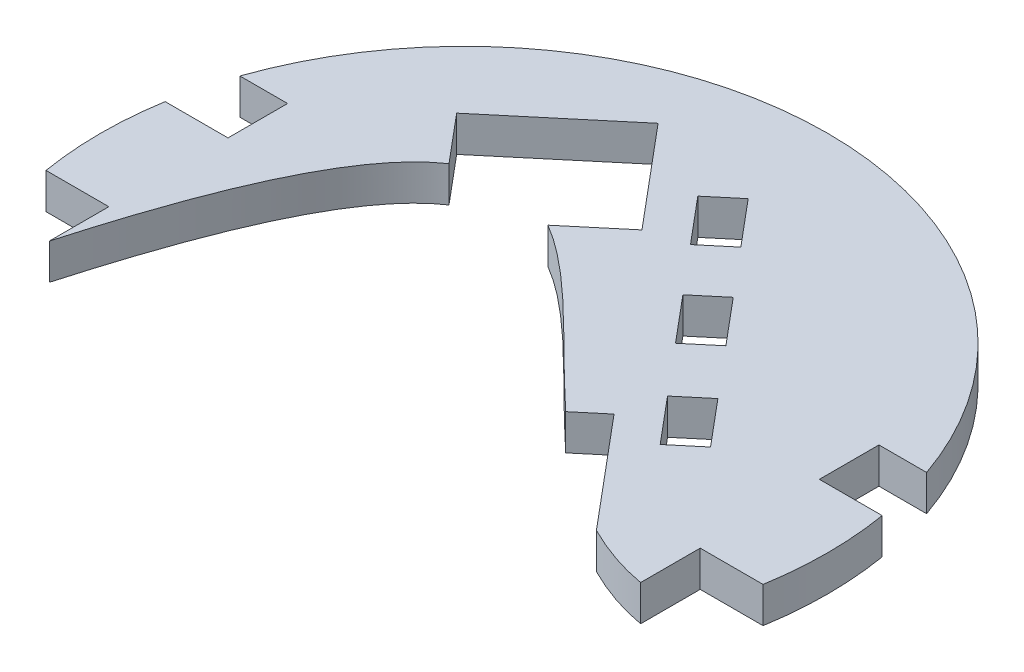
SolidWorks part; units mm, degrees
ref_plane "Alzado" through (0, 0, 0) normal (0, 0, 1) x (1, 0, 0)
ref_plane "Planta" through (0, 0, 0) normal (0, 1, 0) x (1, 0, 0)
ref_plane "Vista lateral" through (0, 0, 0) normal (1, 0, 0) x (0, 0, -1)
sketch "Croquis1" plane through (0, 0, 0) normal (0, 1, 0) x (1, 0, 0)
  circle A0 centre (0, 0) radius 30.5
extrude "Saliente-Extruir1" add sketch "Croquis1" along normal blind 3
sketch "Croquis2" plane through (0, 3, 0) normal (0, 1, 0) x (1, 0, 0)
  circle A0 centre (0, 0) radius 2
extrude "Cortar-Extruir1" cut sketch "Croquis2" against normal blind 4
sketch "Croquis5" plane through (0, 3, 0) normal (0, 1, 0) x (1, 0, 0)
  line L0 (0, 0) -> (0, 10)
  line L1 (28.8141, -5) -> (30.0874, -5)
  line L2 (28.8141, 5) -> (30.0874, 5)
  line L3 (-24.8141, 10) -> (-28.8141, 10)
  line L4 (24.8141, -5) -> (24.8141, -10)
  line L5 (-24.8141, -10) -> (-28.8141, -10)
  line L6 (24.8141, -5) -> (28.8141, -5)
  line L7 (24.8141, 5) -> (24.8141, 10)
  line L8 (-24.8141, 5) -> (-28.8141, 5)
  line L9 (-24.8141, 5) -> (-24.8141, 10)
  line L10 (-24.8141, -5) -> (-28.8141, -5)
  line L11 (-24.8141, -5) -> (-24.8141, -10)
  line L12 (24.8141, 5) -> (28.8141, 5)
  line L13 (24.8141, -10) -> (28.8141, -10)
  line L14 (24.8141, 10) -> (28.8141, 10)
  line L15 (-28.8141, 5) -> (-30.0874, 5)
  line L16 (-28.8141, -5) -> (-30.0874, -5)
  circle A1 centre (0, 0) radius 30.5 construction
  arc A2 (-28.8141, 10) -> (-30.0874, 5) centre (0, 0) ccw
  arc A3 (28.8141, 10) -> (28.8141, -10) centre (0, 0) cw
  arc A4 (-30.0874, -5) -> (-28.8141, -10) centre (0, 0) ccw
  arc A5 (30.0874, -5) -> (28.8141, -10) centre (0, 0) cw
  arc A6 (28.8141, 10) -> (30.0874, 5) centre (0, 0) cw
extrude "Cortar-Extruir3" cut sketch "Croquis5" against normal blind 4
sketch "Croquis7" plane through (0, 3, 0) normal (0, 1, 0) x (1, 0, 0)
  line L0 (-8.1011, 29.1011) -> (9.5756, 8.0348)
  line L1 (-1.4002, 16.4481) -> (-0.7574, 15.682)
  line L2 (-8.1011, 29.1011) -> (-27.2522, 13.0314)
  line L3 (27.2522, -13.0314) -> (8.1011, -29.1011)
  line L4 (8.1011, -29.1011) -> (-27.2522, 13.0314)
  line L5 (1.4284, 22.4114) -> (-0.8697, 20.4831)
  line L6 (1.4284, 22.4114) -> (4.6423, 18.5812)
  line L7 (4.6423, 18.5812) -> (2.3442, 16.6528)
  line L8 (2.3442, 16.6528) -> (-0.8697, 20.4831)
  line L9 (-24.8141, -10) -> (-28.8141, -10)
  line L10 (24.8141, -10) -> (28.8141, -10)
  line L11 (9.5756, 8.0348) -> (18.4139, -2.4983)
  line L12 (18.4139, -2.4983) -> (27.2522, -13.0314)
  line L13 (11.4555, 1.1272) -> (19.169, -8.0653)
  line L14 (19.169, -8.0653) -> (9.9765, -15.7788)
  line L15 (9.9765, -15.7788) -> (2.263, -6.5863)
  line L16 (11.4555, 1.1272) -> (2.263, -6.5863)
  line L17 (-1.4002, 16.4481) -> (-7.8281, 24.1085)
  line L18 (-1.4002, 16.4481) -> (-10.5927, 8.7346)
  line L19 (-10.5927, 8.7346) -> (-17.0206, 16.3951)
  line L20 (-7.8281, 24.1085) -> (-17.0206, 16.3951)
  line L21 (16.2929, 4.6967) -> (14.6859, 6.6118)
  line L22 (16.2929, 4.6967) -> (17.8998, 2.7815)
  line L23 (14.6859, 6.6118) -> (12.3878, 4.6834)
  line L24 (17.8998, 2.7815) -> (15.6017, 0.8532)
  line L25 (15.6017, 0.8532) -> (12.3878, 4.6834)
  line L26 (-0.7574, 15.682) -> (-5.0494, 12.0807)
  arc A1 (-28.8141, -10) -> (28.8141, -10) centre (0, 0) ccw
  spline S0 degree 3 poles (24.8141, -10) (2.6081, -6.0995) (-10.3265, 41.1093) (-24.8141, -10) knots 0 0 0 0 1 1 1 1
  point P7 (-9.5756, -8.0348)
extrude "Cortar-Extruir5" cut sketch "Croquis7" against normal blind 4
sketch "Croquis9" plane through (0, 3, 0) normal (0, 1, 0) x (1, 0, 0)
  line L0 (-8.3073, 29.3469) -> (22.8679, -7.8063)
  line L2 (7.9714, 14.6138) -> (11.1854, 10.7835)
  line L3 (-8.3073, 29.3469) -> (-21.7131, 18.0981)
  line L4 (-21.7131, 18.0981) -> (9.4621, -19.0551)
  line L5 (9.4621, -19.0551) -> (22.8679, -7.8063)
  line L6 (11.1854, 10.7835) -> (8.8872, 8.8552)
  line L7 (7.9714, 14.6138) -> (5.6733, 12.6854)
  arc A1 (28.8141, 10) -> (-28.8141, 10) centre (0, 0) ccw construction
extrude "Cortar-Extruir6" cut sketch "Croquis9" against normal blind 10 contours L2 L7 L0 L6
